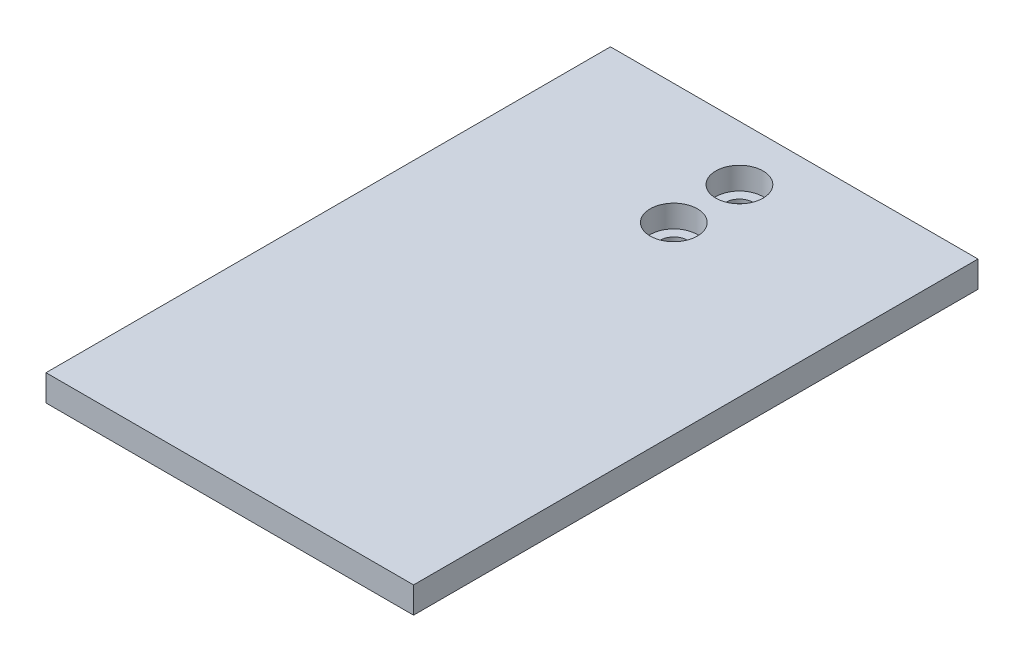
SolidWorks part; units mm, degrees
ref_plane "Front Plane" through (0, 0, 0) normal (0, 0, 1) x (1, 0, 0)
ref_plane "Top Plane" through (0, 0, 0) normal (0, 1, 0) x (1, 0, 0)
ref_plane "Right Plane" through (0, 0, 0) normal (1, 0, 0) x (0, 0, -1)
sketch "Sketch1" plane through (0, 0, 0) normal (0, 1, 0) x (1, 0, 0)
  line L1 (-29, -44) -> (29, -44)
  line L2 (-29, -44) -> (-29, 44)
  line L3 (-29, 44) -> (29, 44)
  line L4 (29, -44) -> (29, 44)
  line L5 (-29, -44) -> (29, 44) construction
  line L6 (-29, 44) -> (29, -44) construction
  point P0 (0, 0)
  dimension "D1" = 58
  dimension "D2" = 88
extrude "Boss-Extrude1" add sketch "Sketch1" along normal blind 3 and the other way blind 1
sketch "Sketch3" plane through (0, 3, 0) normal (0, 1, 0) x (1, 0, 0)
  line L0 (29, 44) -> (-29, 44) construction
  circle A0 centre (0, 34.652) radius 3.6
  circle A1 centre (0, 24.652) radius 3.6
  dimension "D1" = 7.2
  dimension "D2" = 7.2
  dimension "D4" = 9.348
  dimension "D3" = 10
extrude "Cut-Extrude1" cut sketch "Sketch3" against normal blind 3.4
sketch "Sketch4" plane through (0, -0.4, 0) normal (0, 1, 0) x (1, 0, 0)
  circle A0 centre (0, 34.652) radius 2.1
  circle A1 centre (0, 24.652) radius 2.1
  dimension "D1" = 4.2
  dimension "D2" = 4.2
extrude "Cut-Extrude2" cut sketch "Sketch4" against normal blind 2
sketch "Sketch5" plane through (0, 3, 0) normal (0, 1, 0) x (1, 0, 0)
  line L0 (29, 44) -> (-29, 44) construction
  line L1 (-28, -43) -> (28, -43)
  line L2 (-28, -43) -> (-28, 43)
  line L3 (-28, 43) -> (28, 43)
  line L4 (28, -43) -> (28, 43)
  line L5 (-28, -43) -> (28, 43) construction
  line L6 (-28, 43) -> (28, -43) construction
  line L7 (-29, 44) -> (-29, -44) construction
  point P0 (0, 0)
  dimension "D1" = 1
  dimension "D2" = 1
extrude "Cut-Extrude3" cut sketch "Sketch5" against normal blind 10 flip side to cut
